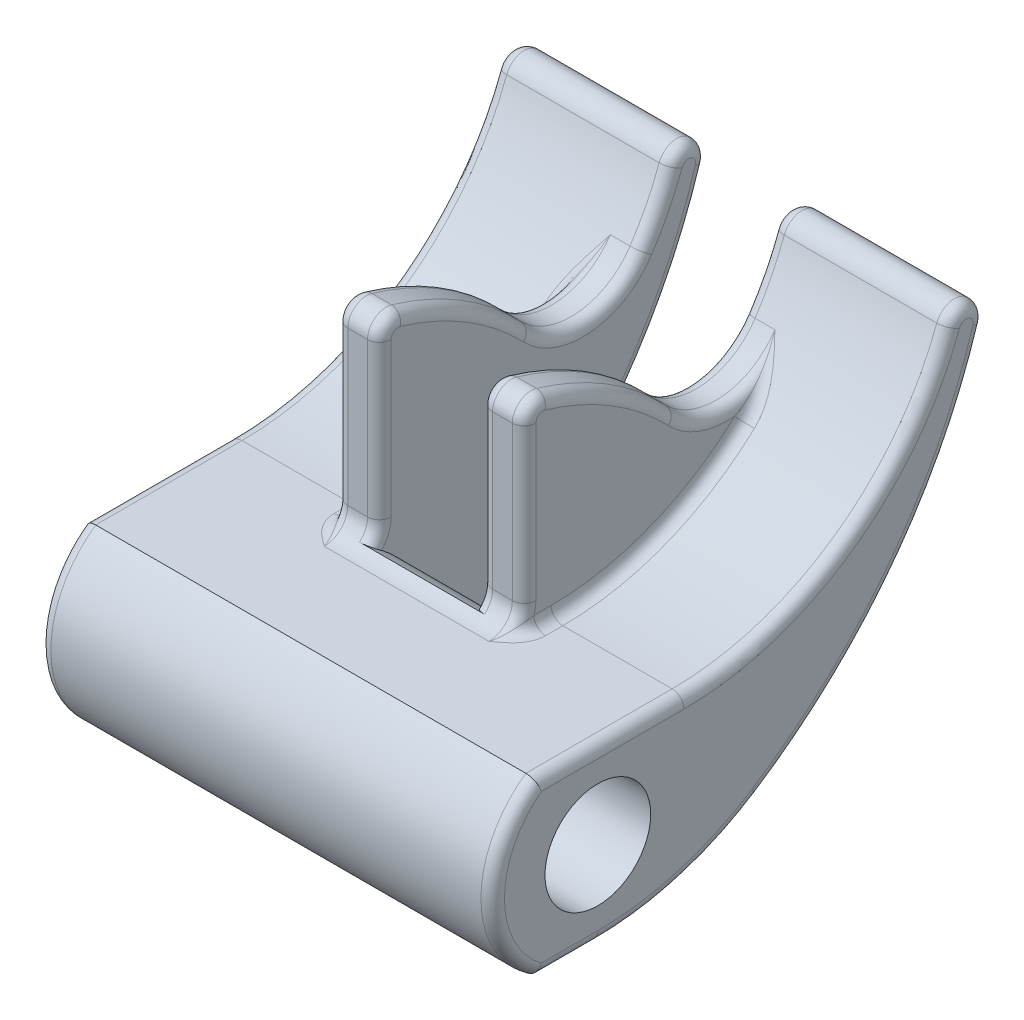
SolidWorks part; units mm, degrees
ref_plane "Спереди" through (0, 0, 0) normal (0, 0, 1) x (1, 0, 0)
ref_plane "Сверху" through (0, 0, 0) normal (0, 1, 0) x (1, 0, 0)
ref_plane "Справа" through (0, 0, 0) normal (1, 0, 0) x (0, 0, -1)
sketch "Эскиз1" plane through (0, 0, 0) normal (1, 0, 0) x (0, 0, -1)
  line L0 (5.8095, 5.8166) -> (-4.0703, 5.8166)
  line L1 (0, -5.8166) -> (-4.0703, -5.8166)
  line L2 (-16.762, 0) -> (89.8037, 0) construction
  circle A0 centre (0, 0) radius 3.5687
  arc A1 (-4.0703, -5.8166) -> (-4.0703, 5.8166) centre (0, 0) cw
  arc A2 (0, -5.8166) -> (10.8315, -2.6325) centre (0, 14.1986) ccw
  arc A3 (10.8315, -2.6325) -> (26.0858, 17.4555) centre (-9.0996, 28.3384) ccw
  arc A4 (23.6811, 18.2705) -> (5.8095, 5.8166) centre (5.8095, 24.8666) cw
  arc A5 (26.0858, 17.4555) -> (23.6811, 18.2705) centre (24.8725, 17.8308) ccw
  point P18 (24.8725, 19.1008)
  point P19 (26.1425, 17.8308)
  dimension "D1" = 7.1374
  dimension "D3" = 20.0152
  dimension "D4" = 36.83
  dimension "D5" = 1.27
  dimension "D8" = 19.05
  dimension "D9" = 7.0993
  dimension "D2" = 11.6332
  dimension "D6" = 19.1008
  dimension "D7" = 26.0858
extrude "Бобышка-Вытянуть1" add sketch "Эскиз1" along normal mid plane 30.6324
sketch "Эскиз2" plane through (0, 0, 0) normal (1, 0, 0) x (0, 0, -1)
  line L0 (5.8095, 5.8166) -> (2.4003, 5.8166)
  line L1 (3.9878, 7.4041) -> (3.9878, 17.7809)
  line L2 (5.8095, 5.8166) -> (-4.0703, 5.8166) construction
  arc A0 (2.4003, 5.8166) -> (3.9878, 7.4041) centre (2.4003, 7.4041) ccw
  arc A1 (3.9878, 17.7809) -> (5.6179, 18.9988) centre (5.2578, 17.7809) cw
  arc A2 (5.6179, 18.9988) -> (14.3021, 13.7101) centre (0, 0) cw
  arc A3 (5.8095, 5.8166) -> (21.717, 14.3855) centre (5.8095, 24.8666) ccw
  arc A4 (21.717, 14.3855) -> (14.3021, 13.7101) centre (17.7401, 17.0058) cw
  arc A5 (5.8095, 5.8166) -> (23.6811, 18.2705) centre (5.8095, 24.8666) ccw construction
  dimension "D1" = 1.5875
  dimension "D3" = 1.27
  dimension "D4" = 19.812
  dimension "D5" = 4.7625
  dimension "D2" = 3.9878
extrude "Бобышка-Вытянуть2" add sketch "Эскиз2" along normal mid plane 12.7 contours A1 A2 A4 A3 L0 A0 L1
sketch "Эскиз3" plane through (0, 0, 0) normal (1, 0, 0) x (0, 0, -1)
  line L0 (0, 7.0993) -> (0, 19.177)
  line L1 (0, 19.177) -> (26.162, 19.177)
  line L2 (26.162, 19.177) -> (26.162, -5.842)
  line L3 (26.162, -5.842) -> (4.0337, -5.842)
  arc A0 (4.0337, -5.842) -> (0, 7.0993) centre (0, 0) ccw
  arc A1 (-4.0703, 5.8166) -> (-4.0703, -5.8166) centre (0, 0) ccw construction
  dimension "D1" = 19.177
  dimension "D2" = 26.162
  dimension "D3" = 5.842
extrude "Вырез-Вытянуть1" cut sketch "Эскиз3" against normal mid plane 6.858
fillet "Скругление1" radius 0.7937 46 edges at (-6.35, 6.2816, -3.5228) (-6.35, 12.2629, -18.1721) (-6.35, 16.921, -10.3051) (-6.35, 18.7983, -4.4977) (6.35, 6.2816, -3.5228) (6.35, 12.2629, -18.1721) (6.35, 16.921, -10.3051) (6.35, 18.7983, -4.4977) (3.429, -4.1822, -7.9218) (3.429, 6.0649, -20.232) (3.429, 19.0336, -25.2802) (3.429, 6.7471, -3.8455) (3.429, 12.5925, -3.9878) (3.429, 18.7983, -4.4977) (3.429, 16.921, -10.3051) (3.429, 12.2629, -18.1721) (-3.429, -4.1822, -7.9218) (-3.429, 6.0649, -20.232) (-3.429, 19.0336, -25.2802) (-3.429, 6.7471, -3.8455) (-3.429, 12.5925, -3.9878) (-3.429, 18.7983, -4.4977) (-3.429, 16.921, -10.3051) (-3.429, 12.2629, -18.1721) (-15.3162, -5.8166, 2.0351) (-15.3162, -5.0041, -5.6449) (-15.3162, 6.0649, -20.232) (-15.3162, 19.0336, -25.2802) (-15.3162, 5.8166, -0.8696) (-6.35, 5.8166, -4.1049) (6.35, 5.8166, -4.1049) (15.3162, -5.8166, 2.0351) (15.3162, -5.0041, -5.6449) (15.3162, 6.0649, -20.232) (15.3162, 19.0336, -25.2802) (15.3162, 5.8166, -0.8696) (-6.35, 12.5925, -3.9878) (6.35, 12.5925, -3.9878) (3.429, 16.2717, -22.8104) (-3.429, 16.2717, -22.8104) (-15.3162, 0, 7.0993) (-15.3162, 9.2372, -16.7009) (-6.35, 8.0951, -14.8438) (6.35, 8.0951, -14.8438) (15.3162, 0, 7.0993) (15.3162, 9.2372, -16.7009)
